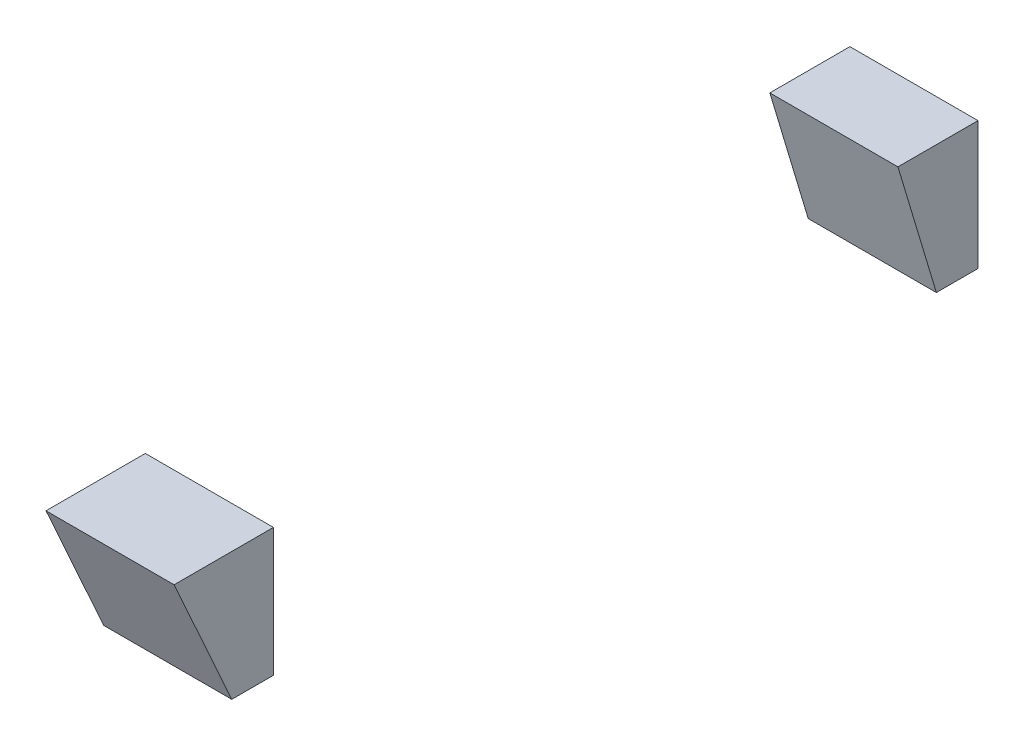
SolidWorks part; units mm, degrees
ref_plane "前视基准面" through (0, 0, 0) normal (0, 0, 1) x (1, 0, 0)
ref_plane "上视基准面" through (0, 0, 0) normal (0, 1, 0) x (1, 0, 0)
ref_plane "右视基准面" through (0, 0, 0) normal (1, 0, 0) x (0, 0, -1)
other "Configuration Table"
sketch "草图1" plane through (0, 0, 0) normal (0, 0, 1) x (1, 0, 0)
  line L0 (-13, -9) -> (-9, -9)
  line L1 (-9, -9) -> (-9, -13)
  line L2 (-9, -13) -> (-13, -13)
  line L3 (-13, -13) -> (-13, -9)
  line L4 (9, 13) -> (13, 13)
  line L5 (13, 13) -> (13, 9)
  line L6 (13, 9) -> (9, 9)
  line L7 (9, 9) -> (9, 13)
extrude "凸台-拉伸1" add sketch "草图1" along normal blind 5
sketch "草图2" plane through (-13, 0, 0) normal (-1, 0, 0) x (0, 0, 1)
  line L0 (1.3, -13) -> (3.101, -9)
  line L2 (5, -9) -> (0, -9) construction
  line L8 (0, -9) -> (0, -13) construction
  point P2 (1.3, -13)
  point P6 (3.101, -9)
  point P8 (1.3, -9)
  dimension "D1" = 3.101
extrude "切除-拉伸1" cut sketch "草图2" against normal through all and the other way through all flip side to cut
sketch "草图3" plane through (13, 0, 0) normal (1, 0, 0) x (0, 0, -1)
  line L0 (-2.5, 13) -> (-1.3, 9)
  line L1 (-5, 13) -> (0, 13) construction
extrude "切除-拉伸2" cut sketch "草图3" against normal through all and the other way through all flip side to cut
